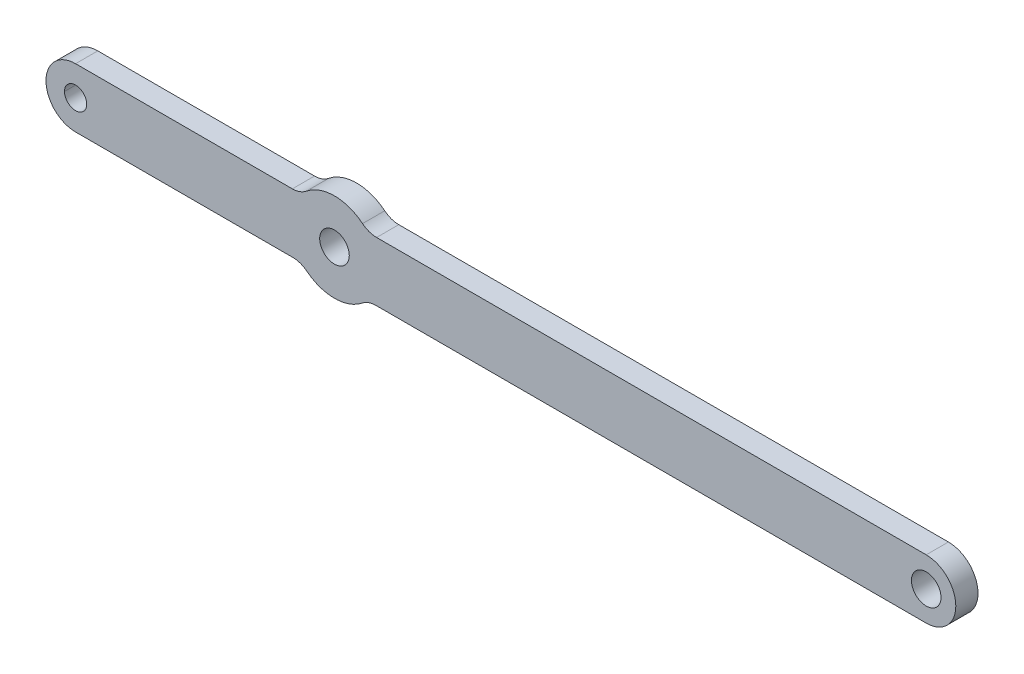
SolidWorks part; units mm, degrees
ref_plane "Front Plane" through (0, 0, 0) normal (0, 0, 1) x (1, 0, 0)
ref_plane "Top Plane" through (0, 0, 0) normal (0, 1, 0) x (1, 0, 0)
ref_plane "Right Plane" through (0, 0, 0) normal (1, 0, 0) x (0, 0, -1)
imported_body "Imported1"
sketch "Sketch1" plane through (0, 0, 3) normal (0, 0, 1) x (1, 0, 0)
  circle A0 centre (136.9102, 73.7472) radius 2
  circle A1 centre (216.9102, 73.7175) radius 2
extrude "Cut-Extrude1" cut sketch "Sketch1" against normal blind 3
